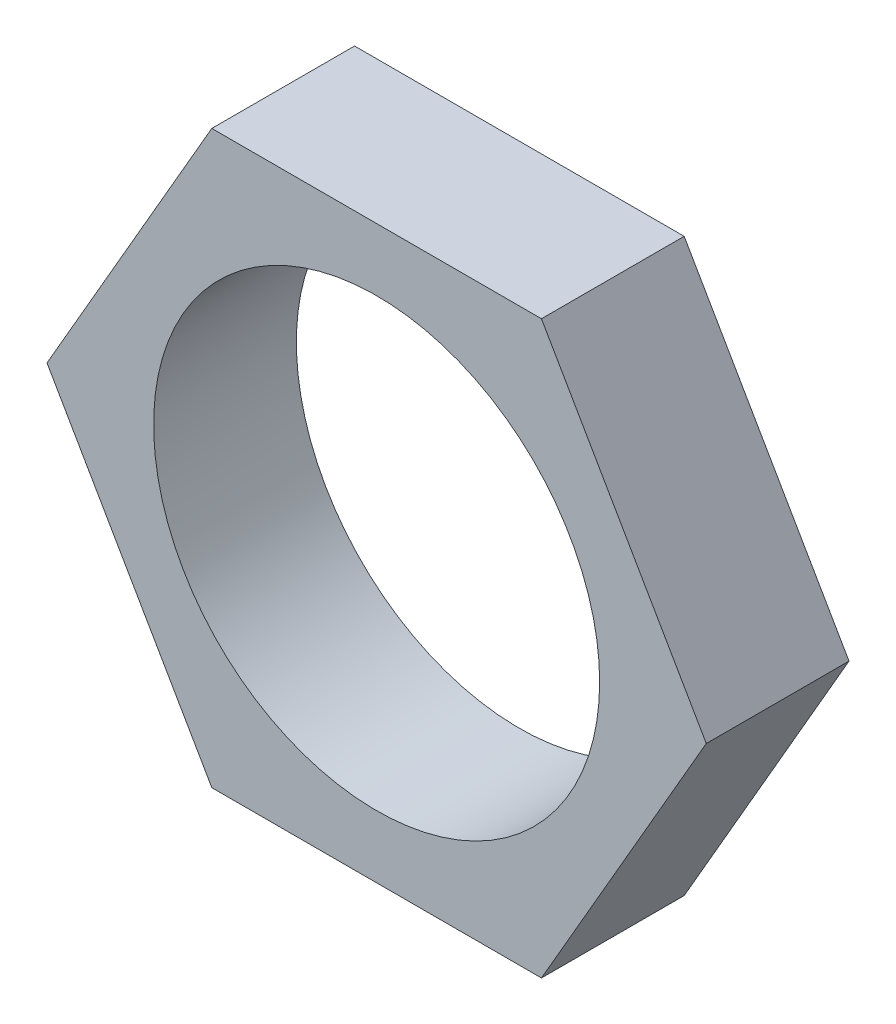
SolidWorks part; units mm, degrees
ref_plane "Plan de face" through (0, 0, 0) normal (0, 0, 1) x (1, 0, 0)
ref_plane "Plan de dessus" through (0, 0, 0) normal (0, 1, 0) x (1, 0, 0)
ref_plane "Plan de droite" through (0, 0, 0) normal (1, 0, 0) x (0, 0, -1)
sketch "Esquisse1" plane through (0, 0, 0) normal (0, 0, 1) x (1, 0, 0)
  line L1 (18.4752, 0) -> (9.2376, 16)
  line L2 (9.2376, 16) -> (-9.2376, 16)
  line L3 (-9.2376, 16) -> (-18.4752, 0)
  line L4 (-18.4752, 0) -> (-9.2376, -16)
  line L5 (-9.2376, -16) -> (9.2376, -16)
  line L6 (9.2376, -16) -> (18.4752, 0)
  circle A0 centre (0, 0) radius 16 construction
  dimension "D1" = 32
extrude "Extrusion1" add sketch "Esquisse1" against normal blind 8
hole_wizard "Trou taraudé M27x2.01" positions "Esquisse3" profile "Esquisse2" tap size "M27x2.0" standard "ISO"
sketch "Esquisse3" plane through (0, 0, 0) normal (0, 0, 1) x (1, 0, 0)
  point P0 (0, 0)
sketch "Esquisse2" plane through (0, 0, 0) normal (1, 0, 0) x (0, -1, 0)
  line L0 (0, 0) -> (0, 8)
  line L1 (0, 8) -> (12.5, 8)
  line L2 (12.5, 8) -> (12.5, 0)
  line L5 (12.5, 0) -> (0, 0)
  line L11 (0, -6.35) -> (0, 107.95) construction
  dimension "Diamètre du trou pour taraudage jusqu'au prochain" = 25
  dimension "Profondeur du trou pour taraudage jusqu'au prochain" = 8
